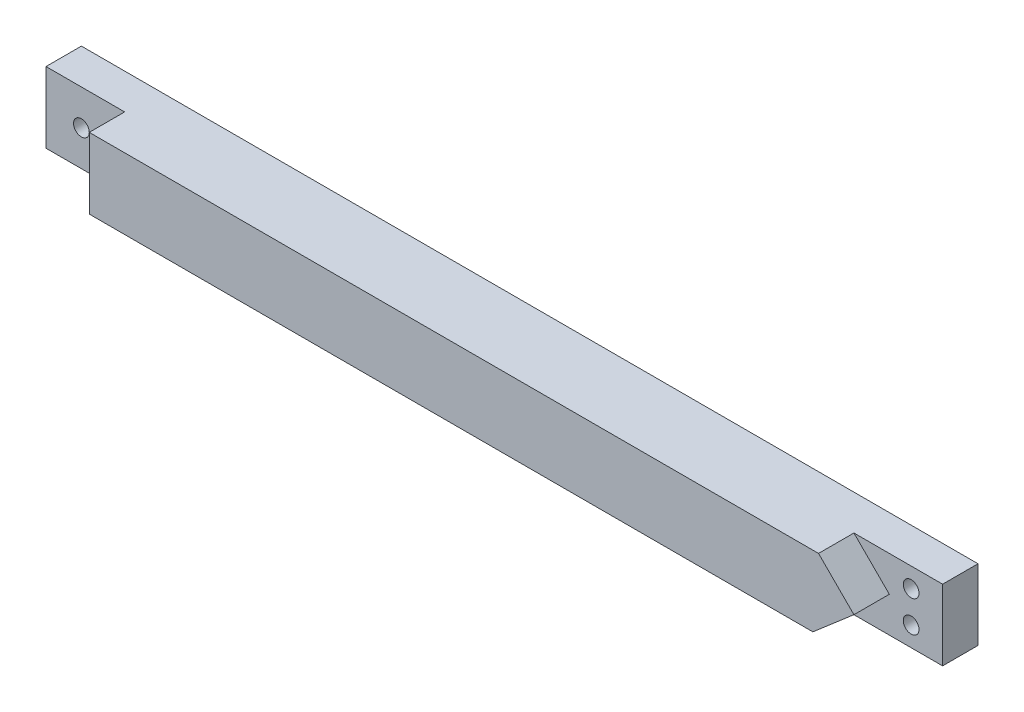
SolidWorks part; units mm, degrees
ref_plane "Plan de face" through (0, 0, 0) normal (0, 0, 1) x (1, 0, 0)
ref_plane "Plan de dessus" through (0, 0, 0) normal (0, 1, 0) x (1, 0, 0)
ref_plane "Plan de droite" through (0, 0, 0) normal (1, 0, 0) x (0, 0, -1)
sketch "Esquisse1" plane through (0, 0, 0) normal (0, 0, 1) x (1, 0, 0)
  line L1 (0, 0) -> (114, 0)
  line L2 (0, 0) -> (0, 9)
  line L3 (0, 9) -> (114, 9)
  line L4 (114, 0) -> (114, 9)
  dimension "D1" = 114
  dimension "D2" = 9
extrude "Extrusion1" add sketch "Esquisse1" along normal blind 9
sketch "Esquisse2" plane through (0, 0, 9) normal (0, 0, 1) x (1, 0, 0)
  line L0 (114, 9) -> (0, 9) construction
  line L1 (0, 0) -> (10, 0)
  line L2 (0, 0) -> (0, 9)
  line L3 (0, 9) -> (10, 9)
  line L4 (10, 0) -> (10, 9)
  dimension "D1" = 10
extrude "Enlèv. mat.-Extru.1" cut sketch "Esquisse2" against normal blind 4.5
sketch "Esquisse3" plane through (0, 0, 4.5) normal (0, 0, 1) x (1, 0, 0)
  line L0 (0, 9) -> (0, 0) construction
  line L1 (10, 9) -> (0, 9) construction
  circle A0 centre (4.5, 4.5) radius 1
  point P4 (5, 9)
  dimension "D3" = 2
  dimension "D1" = 4.5
  dimension "D2" = 4.5
extrude "Enlèv. mat.-Extru.2" cut sketch "Esquisse3" against normal blind 4.5
sketch "Esquisse4" plane through (0, 0, 9) normal (0, 0, 1) x (1, 0, 0)
  line L0 (114, 9) -> (102.7247, 9)
  line L1 (114, 9) -> (10, 9) construction
  line L2 (102.7247, 9) -> (107.2247, 4.5)
  line L3 (107.2247, 4.5) -> (102, 0)
  line L4 (10, 0) -> (114, 0) construction
  line L5 (102, 0) -> (114, 0)
  line L6 (114, 0) -> (114, 9)
  dimension "D1" = 4.5
  dimension "D2" = 12
extrude "Enlèv. mat.-Extru.3" cut sketch "Esquisse4" against normal blind 4.5
sketch "Esquisse5" plane through (0, 0, 4.5) normal (0, 0, 1) x (1, 0, 0)
  line L0 (114, 0) -> (114, 9) construction
  line L1 (114, 9) -> (102.7247, 9) construction
  line L2 (102, 0) -> (114, 0) construction
  circle A0 centre (110, 6.5) radius 1
  circle A1 centre (110, 2.5) radius 1
  dimension "D5" = 2
  dimension "D6" = 2
  dimension "D1" = 4
  dimension "D2" = 4
  dimension "D3" = 2.5
  dimension "D4" = 2.5
extrude "Enlèv. mat.-Extru.4" cut sketch "Esquisse5" against normal blind 4.5
